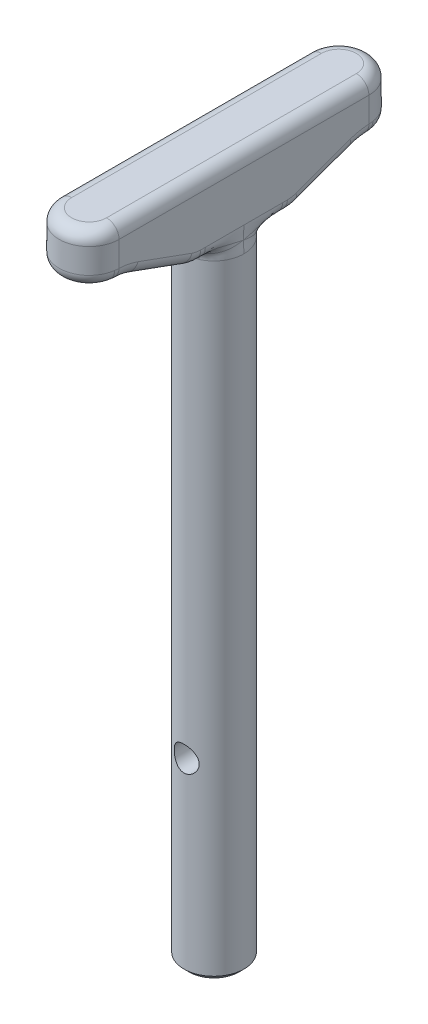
SolidWorks part; units mm, degrees
ref_plane "Front Plane" through (0, 0, 0) normal (0, 0, 1) x (1, 0, 0)
ref_plane "Top Plane" through (0, 0, 0) normal (0, 1, 0) x (1, 0, 0)
ref_plane "Right Plane" through (0, 0, 0) normal (1, 0, 0) x (0, 0, -1)
sketch "Sketch1" plane through (0, 0, 0) normal (0, 1, 0) x (1, 0, 0)
  line L0 (-12, 50) -> (-12, -50)
  line L1 (12, -50) -> (12, 50)
  line L2 (0, 50) -> (0, -50) construction
  arc A0 (12, 50) -> (-12, 50) centre (0, 50) ccw
  arc A1 (-12, -50) -> (12, -50) centre (0, -50) ccw
  dimension "D1" = 100
  dimension "D2" = 12
extrude "Boss-Extrude1" add sketch "Sketch1" against normal blind 30
sketch "Sketch2" plane through (0, -30, 0) normal (0, -1, 0) x (1, 0, 0)
  line L1 (12, 50) -> (12, -50) construction
  circle A0 centre (0, 0) radius 12
extrude "Boss-Extrude2" add sketch "Sketch2" along normal blind 255
sketch "Sketch4" plane through (0, 0, 0) normal (1, 0, 0) x (0, 0, -1)
  line L0 (-62, -20) -> (-51.0013, -20)
  line L1 (-62, 0) -> (-62, -30) construction
  line L2 (-44.1609, -21.2061) -> (-20, -30)
  line L4 (-50, -30) -> (0, -30) construction
  line L5 (-50, 0) -> (-62, 0) construction
  line L6 (0, -285) -> (0, -30) construction
  arc A0 (-51.0013, -20) -> (-44.1609, -21.2061) centre (-51.0013, -40) cw
  dimension "D1" = 20
  dimension "D2" = 20
  dimension "D3" = 20
  dimension "D4" = 20
extrude "Cut-Extrude1" cut sketch "Sketch4" against normal through all both and the other way through all flip side to cut
mirror "Mirror1" about plane through (0, 0, 0) normal (0, 0, 1) of "Cut-Extrude1"
fillet "Fillet5" radius 15 2 edges at (0, -30, -20) (0, -30, 20)
fillet "Fillet6" radius 5 28 edges at (12, -30, -8.6775) (-12, -30, 8.6775) (0, -30, -12) (0, -30, 12) (-12, -25.1508, 33.3232) (-12, -20.397, 47.0362) (0, -20, 62) (12, -20.397, 47.0362) (-12, -20.397, -47.0362) (0, -20, -62) (12, -20.397, -47.0362) (-12, -25.1508, -33.3232) (12, 0, 0) (0, 0, 62) (12, -25.1508, -33.3232) (-12, -30, -8.6775) (-12, -29.7721, 19.9598) (-12, -29.7721, -19.9598) (-12, 0, 0) (12, -25.1508, 33.3232) (12, -30, 8.6775) (12, -29.7721, 19.9598) (12, -29.7721, -19.9598) (0, 0, -62)
hole_wizard "Ø10.0 (10) Diameter Hole2" positions "3DSketch2" profile "Sketch5" hole size "Ø10.0" standard "ANSI Metric"
sketch3d "3DSketch2"
  point P0 (0, -210, 12)
  dimension "D1" = 75
sketch "Sketch5" plane through (0, -210, 12) normal (1, 0, 0) x (0, -1, 0)
  line L0 (0, 0) -> (0, 74)
  line L1 (0, 74) -> (5, 74)
  line L2 (5, 74) -> (5, 0)
  line L5 (5, 0) -> (0, 0)
  line L11 (0, -6.35) -> (0, 107.95) construction
  dimension "Thru Hole Dia." = 10
  dimension "Thru Hole Depth" = 74
chamfer "Chamfer1" distance 2 angle 45 1 edges at (0, -285, -12)
